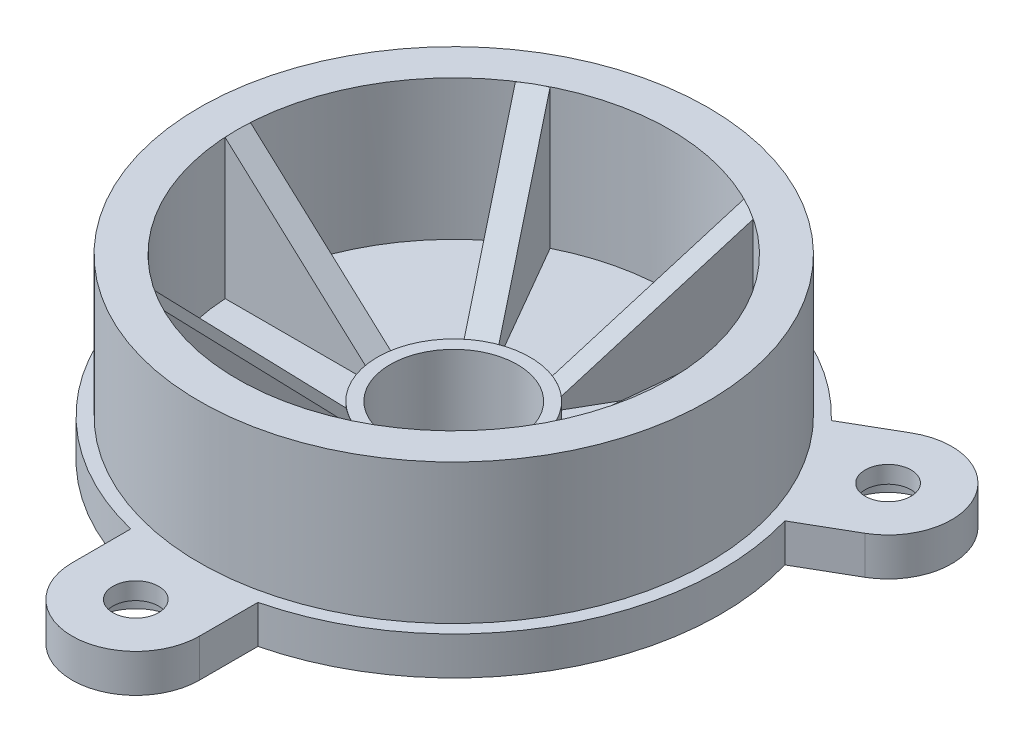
SolidWorks part; units mm, degrees
ref_plane "Front Plane" through (0, 0, 0) normal (0, 0, 1) x (1, 0, 0)
ref_plane "Top Plane" through (0, 0, 0) normal (0, 1, 0) x (1, 0, 0)
ref_plane "Right Plane" through (0, 0, 0) normal (1, 0, 0) x (0, 0, -1)
sketch "Sketch1" plane through (0, 0, 0) normal (1, 0, 0) x (0, 0, -1)
  line L0 (0, 0) -> (0, 17.8779) construction
  line L1 (6, 6) -> (5, 6)
  line L2 (5, 6) -> (5, 0)
  line L3 (5, 0) -> (10, 0)
  line L4 (10, 0) -> (10, 2)
  line L5 (10, 2) -> (21, 2)
  line L6 (21, 2) -> (21, 5)
  line L7 (21, 5) -> (20, 5)
  line L8 (20, 5) -> (20, 16)
  line L9 (20, 16) -> (17, 16)
  line L10 (17, 16) -> (17, 5)
  line L11 (17, 5) -> (6, 5)
  line L12 (6, 5) -> (6, 6)
  dimension "D1" = 10
  dimension "D2" = 20
  dimension "D3" = 42
  dimension "D4" = 40
  dimension "D5" = 34
  dimension "D6" = 2
  dimension "D7" = 3
  dimension "D8" = 1
  dimension "D9" = 12
  dimension "D10" = 11
revolve "Revolve1" add sketch "Sketch1" angle 360 about L0
sketch "Sketch2" plane through (0, 5, 0) normal (0, 1, 0) x (1, 0, 0)
  line L0 (-5, -19.3649) -> (-5, -25)
  line L1 (5, -25) -> (5, -19.3649)
  line L2 (0, 0) -> (0, -25) construction
  arc A0 (-5, -25) -> (5, -25) centre (0, -25) ccw
  circle A1 centre (0, 0) radius 25 construction
  circle A2 centre (0, 0) radius 20 construction
  circle A3 centre (0, 0) radius 20 construction
  arc A4 (-5, -19.3649) -> (5, -19.3649) centre (0, 0) ccw
  dimension "D1" = 50
  dimension "D2" = 5
extrude "Boss-Extrude1" add sketch "Sketch2" against normal up to surface (3 mm away)
hole_wizard "CBORE for M3 SBHCS1" positions "Sketch3" profile "Sketch4" counterbore size "M3" standard "ANSI Metric"
sketch "Sketch3" plane through (0, 2, 0) normal (0, -1, 0) x (-1, 0, 0)
  arc A0 (-5, -25) -> (5, -25) centre (0, -25) ccw construction
  point P0 (0, -25)
sketch "Sketch4" plane through (0, 2, 25) normal (1, 0, 0) x (0, 0, -1)
  line L0 (0, 0) -> (0, 14)
  line L1 (0, 14) -> (1.8, 14)
  line L3 (1.8, 14) -> (1.8, 1.65)
  line L4 (1.8, 1.65) -> (3.35, 1.65)
  line L5 (3.35, 1.65) -> (3.35, 0)
  line L7 (3.35, 0) -> (0, 0)
  line L11 (0, -6.35) -> (0, 107.95) construction
  dimension "Thru Hole Dia." = 3.6
  dimension "Thru Hole Depth" = 14
  dimension "C'Bore Dia." = 6.7
  dimension "C'Bore Depth" = 1.65
pattern_circular "CirPattern1" count 3 over 360 about axis through (0, 0, 0) along (0, 1, 0) of "Boss-Extrude1", "CBORE for M3 SBHCS1"
sketch "Sketch5" plane through (0, 0, 0) normal (0, 0, 1) x (1, 0, 0)
  line L0 (-6, 6) -> (-17, 16)
rib "Rib1" sketch "Sketch5" sketch "Sketch5" thickness 2 extrusion direction parallel to sketch draft on no parameters "D1"=2
pattern_circular "CirPattern2" count 6 over 360 about axis through (0, 0, 0) along (0, 1, 0) of "Rib1"
